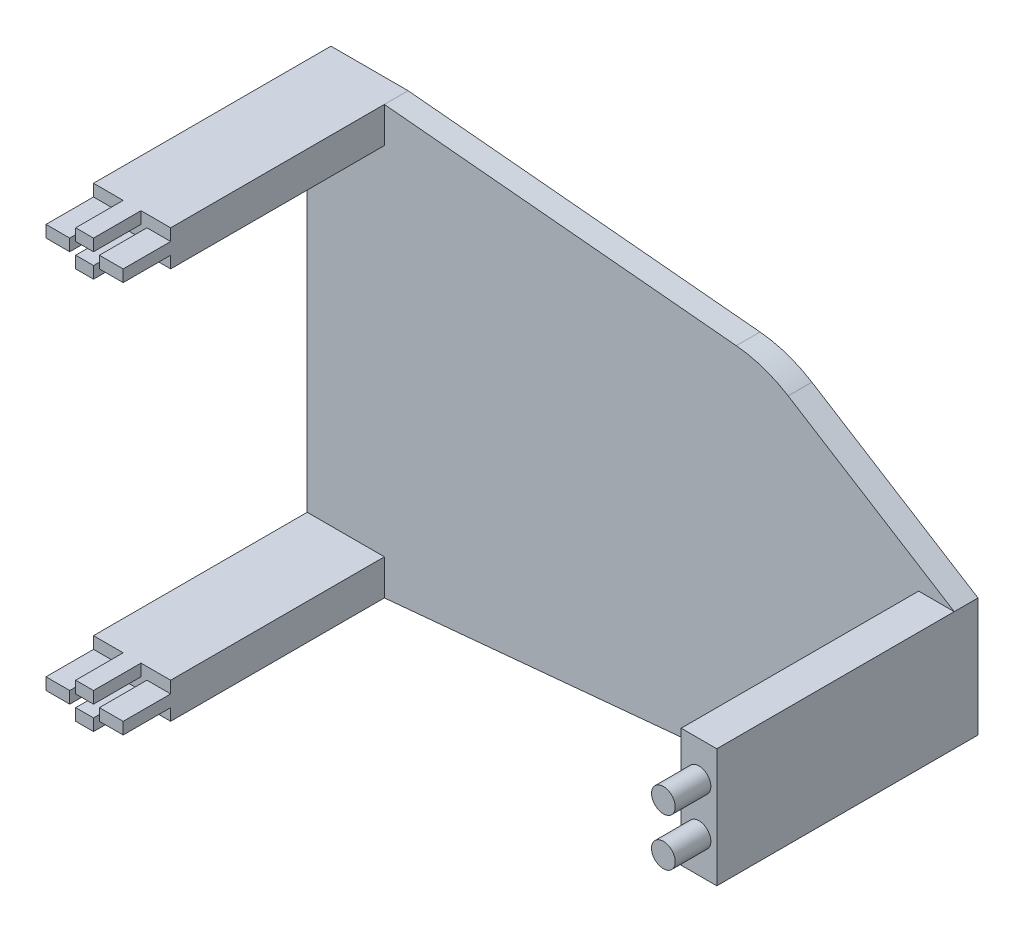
SolidWorks part; units mm, degrees
ref_plane "前视基准面" through (0, 0, 0) normal (0, 0, 1) x (1, 0, 0)
ref_plane "上视基准面" through (0, 0, 0) normal (0, 1, 0) x (1, 0, 0)
ref_plane "右视基准面" through (0, 0, 0) normal (1, 0, 0) x (0, 0, -1)
sketch "草图1" plane through (0, 0, 0) normal (0, 0, 1) x (1, 0, 0)
  line L0 (19.25, 15) -> (35.25, 5)
  line L1 (19.25, 15) -> (-19.25, 15)
  line L2 (19.25, 15) -> (19.25, -15)
  line L3 (19.25, -15) -> (-19.25, -15)
  line L4 (-19.25, 15) -> (-19.25, -15)
  line L5 (19.25, 15) -> (-19.25, -15) construction
  line L6 (19.25, -15) -> (-19.25, 15) construction
  line L7 (35.25, 5) -> (35.25, -5)
  line L8 (35.25, -5) -> (19.25, -15)
  line L9 (19.25, 0) -> (35.25, 0) construction
  point P0 (0, 0)
  dimension "D1" = 38.5
  dimension "D2" = 30
  dimension "D3" = 16
  dimension "D4" = 10
extrude "凸台-拉伸1" add sketch "草图1" along normal blind 2 contours L8 L7 L0 L2 | L1 L4 L3 L2
sketch "草图3" plane through (0, 0, 2) normal (0, 0, 1) x (1, 0, 0)
  line L1 (-19.25, 15) -> (-12.75, 15)
  line L2 (-19.25, 15) -> (-19.25, 18)
  line L3 (-19.25, 18) -> (-12.75, 18)
  line L4 (-12.75, 15) -> (-12.75, 18)
  line L5 (-19.25, -15) -> (-12.75, -15)
  line L6 (-19.25, -15) -> (-19.25, -18)
  line L7 (-19.25, -18) -> (-12.75, -18)
  line L8 (-12.75, -15) -> (-12.75, -18)
  dimension "D1" = 3
  dimension "D2" = 6.5
  dimension "D3" = 6.5
  dimension "D4" = 3
extrude "凸台-拉伸2" add sketch "草图3" along normal blind 20 from offset 2
sketch "草图4" plane through (0, 0, 20) normal (0, 0, 1) x (1, 0, 0)
  line L0 (-19.25, 16.5) -> (-12.75, 16.5) construction
  line L1 (-19.25, 18) -> (-19.25, 15) construction
  line L2 (-12.75, 15) -> (-12.75, 18) construction
  line L3 (-16, 18) -> (-16, 15) construction
  line L4 (-12.75, 18) -> (-19.25, 18) construction
  line L5 (-19.25, 15) -> (-12.75, 15) construction
  line L6 (-19.25, 17) -> (-19.25, 16)
  line L7 (-14.75, 17) -> (-17.25, 17)
  line L8 (-14.75, 17) -> (-14.75, 16)
  line L9 (-14.75, 16) -> (-17.25, 16)
  line L10 (-17.25, 17) -> (-17.25, 16)
  line L11 (-14.75, 17) -> (-17.25, 16) construction
  line L12 (-14.75, 16) -> (-17.25, 17) construction
  line L13 (-16.75, 17) -> (-19.25, 17)
  line L14 (-16.75, 17) -> (-16.75, 18)
  line L15 (-16.75, 18) -> (-19.25, 18)
  line L16 (-19.25, 17) -> (-19.25, 18)
  line L17 (-15.25, 17) -> (-12.75, 17)
  line L18 (-15.25, 17) -> (-15.25, 18)
  line L19 (-15.25, 18) -> (-12.75, 18)
  line L20 (-12.75, 17) -> (-12.75, 18)
  line L21 (-15.25, 16) -> (-12.75, 16)
  line L22 (-15.25, 16) -> (-15.25, 15)
  line L23 (-15.25, 15) -> (-12.75, 15)
  line L24 (-12.75, 16) -> (-12.75, 15)
  line L25 (-16.75, 16) -> (-19.25, 16)
  line L26 (-16.75, 16) -> (-16.75, 15)
  line L27 (-16.75, 15) -> (-19.25, 15)
  line L28 (-19.25, 16) -> (-19.25, 15)
  line L29 (-16.75, 18) -> (-15.25, 18)
  line L30 (-12.75, 17) -> (-12.75, 16)
  line L31 (-15.25, 15) -> (-16.75, 15)
  point P12 (-16, 16.5)
  dimension "D1" = 1
  dimension "D2" = 2.5
  dimension "D3" = 2.5
  dimension "D4" = 2.5
  dimension "D5" = 2.5
  dimension "D6" = 2.5
extrude "凸台-拉伸3" add sketch "草图4" along normal blind 4 contours L25 L10 L13 M10 | L7 L18 L14 M13 | L8 L21 L17 M12 | L9 L26 L22 M11
mirror "镜向1" about plane through (0, 0, 0) normal (0, 1, 0) of "凸台-拉伸3"
sketch "草图5" plane through (0, 0, 2) normal (0, 0, 1) x (1, 0, 0)
  line L1 (35.25, 5) -> (32.25, 5)
  line L2 (35.25, 5) -> (35.25, -5)
  line L3 (35.25, -5) -> (32.25, -5)
  line L4 (32.25, 5) -> (32.25, -5)
  dimension "D1" = 10
  dimension "D2" = 3
extrude "凸台-拉伸4" add sketch "草图5" along normal blind 20
sketch "草图6" plane through (0, 0, 22) normal (0, 0, 1) x (1, 0, 0)
  line L0 (33.75, 2) -> (33.75, 5) construction
  line L1 (35.25, 5) -> (32.25, 5) construction
  line L2 (33.75, -2) -> (33.75, -5) construction
  line L3 (32.25, -5) -> (35.25, -5) construction
  circle A0 centre (33.75, 2) radius 1
  circle A1 centre (33.75, -2) radius 1
  dimension "D1" = 2
  dimension "D2" = 2
  dimension "D3" = 3
  dimension "D4" = 3
extrude "凸台-拉伸5" add sketch "草图6" along normal blind 3
sketch "草图7" plane through (0, 0, 2) normal (0, 0, 1) x (1, 0, 0)
  line L0 (-12.75, 18) -> (19.25, 15)
  line L1 (19.25, 15) -> (-12.75, 15)
  line L2 (-12.75, 15) -> (-12.75, 18)
  line L3 (-12.75, -15) -> (19.25, -15)
  line L4 (19.25, -15) -> (-12.75, -18)
  line L5 (-12.75, -18) -> (-12.75, -15)
extrude "凸台-拉伸6" add sketch "草图7" against normal blind 2
fillet "圆角1" radius 10 2 edges at (19.25, 15, 1) (19.25, -15, 1)
